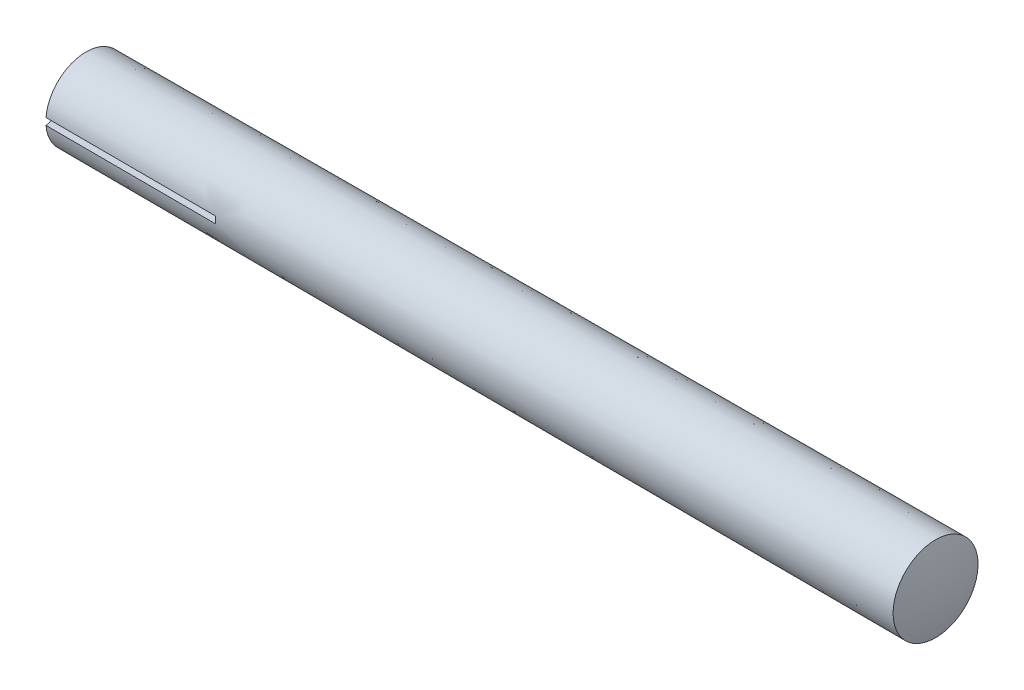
SolidWorks part; units mm, degrees
ref_plane "Front Plane" through (0, 0, 0) normal (0, 0, 1) x (1, 0, 0)
ref_plane "Top Plane" through (0, 0, 0) normal (0, 1, 0) x (1, 0, 0)
ref_plane "Right Plane" through (0, 0, 0) normal (1, 0, 0) x (0, 0, -1)
sketch "BodySke" plane through (0, 0, 0) normal (0, 0, 1) x (1, 0, 0)
  line L0 (-103.4174, 0) -> (209.4275, 0) construction
  line L1 (-0.3618, 0) -> (63.9033, 0)
  line L2 (0, 3.0096) -> (63.5, 3.175)
  line L3 (3.4925, 0) -> (-3.4925, 0) construction
  line L4 (0, 3.0096) -> (0, 0) construction
  line L5 (0, -3.4925) -> (0, 3.4925) construction
  arc A0 (0, 3.0096) -> (-0.3618, 0) centre (12.3382, 0) ccw
  arc A1 (63.5, 3.175) -> (63.9033, 0) centre (51.2033, 0) cw
  dimension "D4" = 12.7
  dimension "D5" = 12.7
  dimension "D2" = 6.0193
  dimension "Diameter" = 6.35
  dimension "Length" = 63.5
revolve "BaseBody" add sketch "BodySke" angle 360 about L0
ref_plane "Plane1" through (12.7, 0, 0) normal (1, 0, 0) x (0, 0, -1)
sketch "SplSke" plane through (0, 0, 0) normal (1, 0, 0) x (0, 0, -1)
  line L0 (6.35, 0.254) -> (6.35, -0.254)
  line L1 (6.35, 0.254) -> (-6.35, 0.254)
  line L2 (-6.35, 0.254) -> (-6.35, -0.254)
  line L3 (6.35, -0.254) -> (-6.35, -0.254)
  line L4 (3.4925, 0) -> (-3.4925, 0) construction
  line L5 (0, 0) -> (0, 5.953) construction
  dimension "D1" = 12.7
  dimension "Split_Width" = 0.508
  dimension "D2" = 0.254
extrude "Split" cut sketch "SplSke" along normal up to surface (12.7 mm away) and the other way through all
equation "\"D4@BodySke\" = \"Diameter@BodySke\"*2"
equation "\"D5@BodySke\" = \"Diameter@BodySke\" * 2"
equation "\"D2@BodySke\" = \"Diameter@BodySke\"-\"Diameter@BodySke\" * \"Length@BodySke\" / 48"
equation "\"D1@Plane1\"=\"Length@BodySke\"*0.2"
equation "\"D2@SplSke\" = \"Split_Width@SplSke\"/2"
equation "\"D1@SplSke\"=\"Diameter@BodySke\" * 2"
